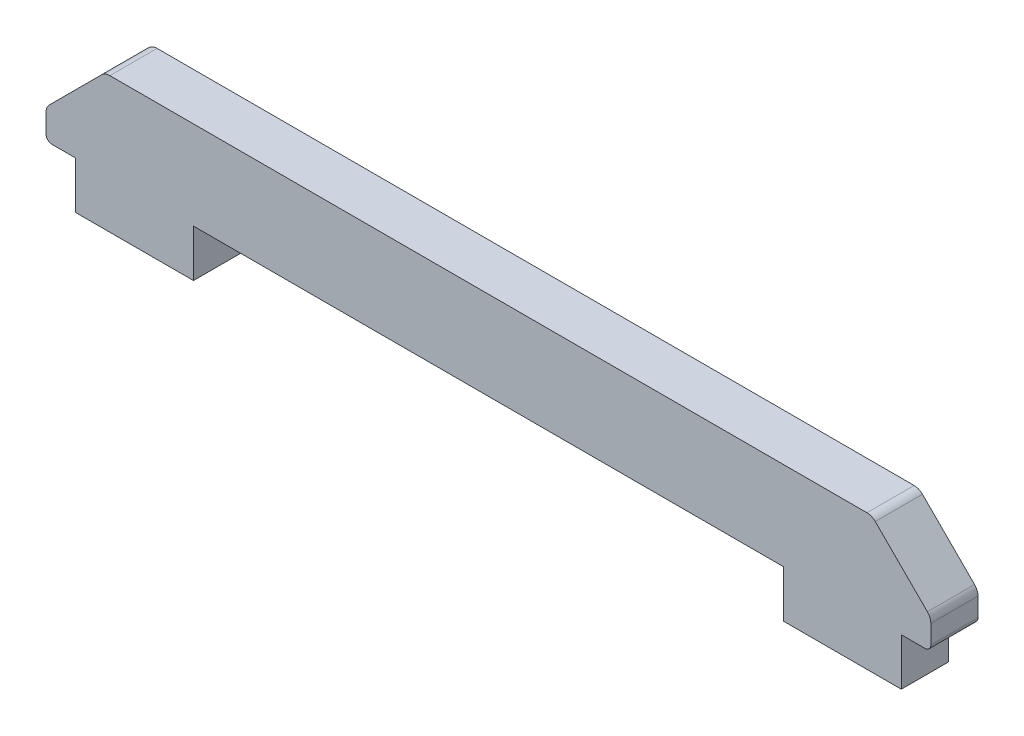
SolidWorks part; units mm, degrees
ref_plane "Front Plane" through (0, 0, 0) normal (0, 0, 1) x (1, 0, 0)
ref_plane "Top Plane" through (0, 0, 0) normal (0, 1, 0) x (1, 0, 0)
ref_plane "Right Plane" through (0, 0, 0) normal (1, 0, 0) x (0, 0, -1)
sketch "Sketch1" plane through (0, 0, 0) normal (0, 0, 1) x (1, 0, 0)
  line L0 (140.5858, -0.5858) -> (149.4142, -9.4142)
  line L1 (10.8284, 0) -> (139.1716, 0)
  line L2 (0, -10.8284) -> (0, -14)
  line L3 (1, -15) -> (5, -15)
  line L4 (150, -10.8284) -> (150, -14)
  line L5 (0.5858, -9.4142) -> (9.4142, -0.5858)
  line L6 (145, -15) -> (149, -15)
  line L8 (145, -15) -> (145, -23)
  line L9 (145, -23) -> (125, -23)
  line L10 (125, -15) -> (125, -23)
  line L12 (25, -15) -> (25, -23)
  line L13 (25, -23) -> (5, -23)
  line L14 (5, -15) -> (5, -23)
  line L15 (25, -15) -> (125, -15)
  arc A0 (0.5858, -9.4142) -> (0, -10.8284) centre (2, -10.8284) ccw
  arc A1 (149.4142, -9.4142) -> (150, -10.8284) centre (148, -10.8284) cw
  arc A2 (9.4142, -0.5858) -> (10.8284, 0) centre (10.8284, -2) cw
  arc A3 (139.1716, 0) -> (140.5858, -0.5858) centre (139.1716, -2) cw
  arc A4 (1, -15) -> (0, -14) centre (1, -14) cw
  arc A5 (149, -15) -> (150, -14) centre (149, -14) ccw
  point P0 (0, 0)
  point P3 (150, 0)
  point P11 (0, -10)
  point P14 (150, -10)
  point P17 (10, 0)
  point P20 (140, 0)
  point P23 (0, -15)
  point P34 (150, -12.4142)
  dimension "D3" = 2
  dimension "D4" = 1
  dimension "D1" = 150
  dimension "D2" = 15
  dimension "D7" = 150
  dimension "D8" = 8
  dimension "D9" = 20
  dimension "D10" = 20
  dimension "D11" = 8
  dimension "D12" = 5
  dimension "D13" = 100
  dimension "D14" = 5
extrude "Boss-Extrude1" add sketch "Sketch1" along normal blind 8
